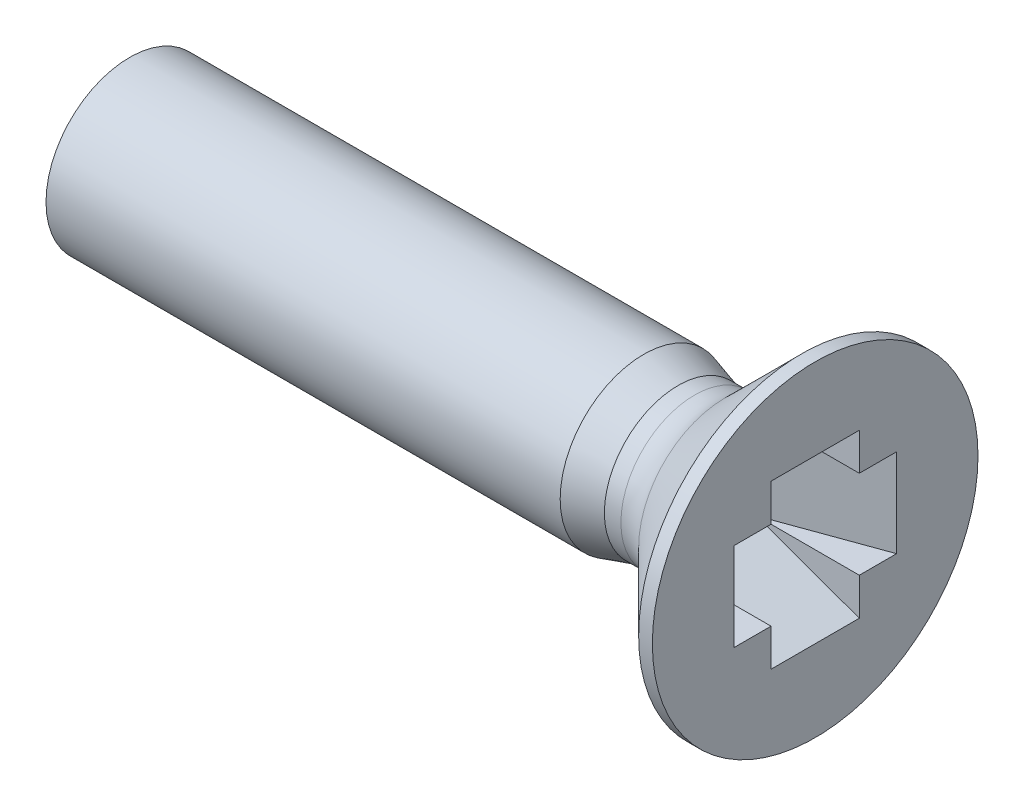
SolidWorks part; units mm, degrees
ref_plane "Plan de face" through (0, 0, 0) normal (0, 0, 1) x (1, 0, 0)
ref_plane "Plan de dessus" through (0, 0, 0) normal (0, 1, 0) x (1, 0, 0)
ref_plane "Plan de droite" through (0, 0, 0) normal (1, 0, 0) x (0, 0, -1)
ref_plane "Plan4" through (0, 0, 0) normal (0, 0, -1) x (-1, 0, 0)
sketch "Esquisse1" plane through (0, 0, 0) normal (0, 0, -1) x (-1, 0, 0)
  line L0 (0, 1.9) -> (0, 0)
  line L1 (0, 0) -> (8, 0)
  line L2 (8, 0) -> (8, 0.9756)
  line L3 (8, 0.9756) -> (2, 0.9756)
  line L4 (2, 0.9756) -> (1.6, 0.86)
  line L5 (1.6, 0.86) -> (1.2, 0.86)
  line L6 (1.2, 0.86) -> (0.16, 1.9)
  line L7 (0.16, 1.9) -> (0, 1.9)
  line L8 (0, 0) -> (8, 0) construction
  dimension "D1" = 8
revolve "Révolution1" add sketch "Esquisse1" angle 360 about L8
ref_plane "Plan5" through (0, 0, 0.515) normal (0, 0, 1) x (1, 0, 0)
sketch "Esquisse2" plane through (0, 0, 0.515) normal (0, 0, 1) x (1, 0, 0)
  line L0 (0, -0.95) -> (0, 0.95)
  line L1 (0, 0.95) -> (-1.2, 0.515)
  line L2 (-1.2, 0.515) -> (-1.2, -0.515)
  line L3 (-1.2, -0.515) -> (0, -0.95)
extrude "Extrusion1" cut sketch "Esquisse2" against normal blind 1.03
ref_plane "Plan6" through (0, -0.515, 0) normal (0, -1, 0) x (1, 0, 0)
sketch "Esquisse3" plane through (0, -0.515, 0) normal (0, -1, 0) x (1, 0, 0)
  line L0 (0, 0.515) -> (0, 0.95)
  line L1 (0, 0.95) -> (-1.2, 0.515)
  line L2 (-1.2, 0.515) -> (0, 0.515)
extrude "Extrusion2" cut sketch "Esquisse3" against normal blind 1.03
ref_plane "Plan7" through (0, -0.515, 0) normal (0, -1, 0) x (1, 0, 0)
sketch "Esquisse4" plane through (0, -0.515, 0) normal (0, -1, 0) x (1, 0, 0)
  line L0 (-1.2, -0.515) -> (0, -0.95)
  line L1 (0, -0.95) -> (0, -0.515)
  line L2 (0, -0.515) -> (-1.2, -0.515)
extrude "Extrusion3" cut sketch "Esquisse4" against normal blind 1.03
fillet "Congé1" radius 0.5 1 edges at (-1.2, 0, 0.86)
